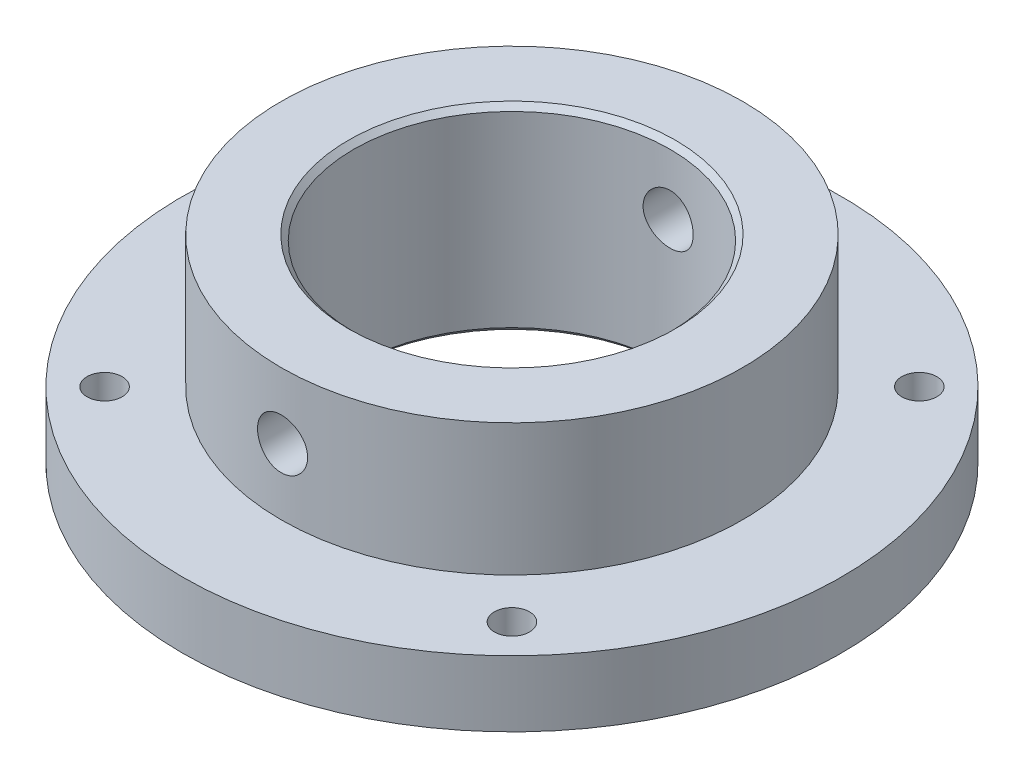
SolidWorks part; units mm, degrees
ref_plane "Front Plane" through (0, 0, 0) normal (0, 0, 1) x (1, 0, 0)
ref_plane "Top Plane" through (0, 0, 0) normal (0, 1, 0) x (1, 0, 0)
ref_plane "Right Plane" through (0, 0, 0) normal (1, 0, 0) x (0, 0, -1)
sketch "Sketch1" plane through (0, 0, 0) normal (0, 0, 1) x (1, 0, 0)
  line L0 (0, 0) -> (0, -59.8277) construction
  line L1 (30.48, 0) -> (44.45, 0)
  line L2 (44.45, 0) -> (44.45, -25.4)
  line L3 (44.45, -25.4) -> (63.5, -25.4)
  line L4 (63.5, -25.4) -> (63.5, -38.1)
  line L5 (63.5, -38.1) -> (30.48, -38.1)
  line L6 (30.48, 0) -> (30.48, -38.1)
  dimension "D1" = 30.48
  dimension "D2" = 38.1
  dimension "D3" = 25.4
  dimension "D4" = 44.45
  dimension "D5" = 63.5
revolve "Revolve1" add sketch "Sketch1" angle 360 about L0
chamfer "Chamfer1" distance 1.016 angle 45 2 edges at (0, 0, 30.48) (0, -38.1, 30.48)
sketch "Sketch2" plane through (0, 0, 0) normal (0, 0, 1) x (1, 0, 0)
  line L0 (31.496, 0) -> (-31.496, 0) construction
  circle A0 centre (0, -12.7) radius 4.826
  dimension "D1" = 12.7
extrude "Cut-Extrude1" cut sketch "Sketch2" against normal mid plane 96.52
sketch "Sketch3" plane through (0, 0, 0) normal (0, 1, 0) x (1, 0, 0)
  line L0 (0, 0) -> (-76.3836, 76.3836) construction
  line L1 (0, 0) -> (0, 87.5474) construction
  circle A0 centre (-39.2437, 39.2437) radius 3.3782
  dimension "D2" = 55.499
  dimension "D1" = 45
extrude "Cut-Extrude2" cut sketch "Sketch3" against normal through all
pattern_circular "CirPattern1" count 4 over 360 about axis through (0, 0, 0) along (0, 1, 0) of "Cut-Extrude2"
